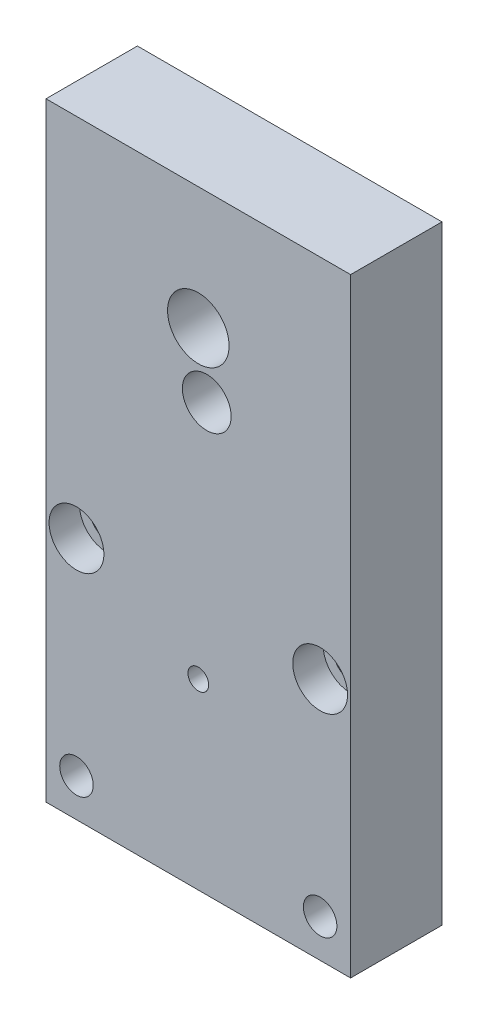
SolidWorks part; units mm, degrees
ref_plane "Face" through (0, 0, 0) normal (0, 0, 1) x (1, 0, 0)
ref_plane "Dessus" through (0, 0, 0) normal (0, 1, 0) x (1, 0, 0)
ref_plane "Droite" through (0, 0, 0) normal (1, 0, 0) x (0, 0, -1)
sketch "Esquisse1" plane through (0, 0, 0) normal (0, 0, 1) x (1, 0, 0)
  line L1 (-50, 0) -> (50, 0)
  line L2 (-50, 0) -> (-50, 200)
  line L3 (-50, 200) -> (50, 200)
  line L4 (50, 0) -> (50, 200)
  dimension "D1" = 200
  dimension "D2" = 100
extrude "Boss.-Extru.1" add sketch "Esquisse1" along normal blind 30
sketch "Esquisse2" plane through (0, 0, 30) normal (0, 0, 1) x (1, 0, 0)
  line L0 (-25, 170) -> (0, 145)
  line L1 (0, 145) -> (25, 170)
  line L2 (25, 170) -> (-25, 170)
  line L3 (0, 145.4) -> (0, -7) construction
  line L4 (50, 200) -> (-50, 200) construction
  line L5 (49.6, 145) -> (151.2, 145) construction
  line L6 (50, 0) -> (50, 200) construction
  dimension "D1" = 30
  dimension "D2" = 50
  dimension "D3" = 25
  dimension "D4" = 50
  dimension "D5" = 90
extrude "Enlèv. mat.-Extru.1" [suppressed] cut sketch "Esquisse2" against normal blind 30
fillet "Congé1" [suppressed] radius 8
sketch "Esquisse3" plane through (0, 0, 30) normal (0, 0, 1) x (1, 0, 0)
  line L0 (50, 0) -> (50, 200) construction
  line L1 (-50, 200) -> (50, 200)
  line L2 (-50, 200) -> (-50, 160)
  line L3 (-50, 160) -> (50, 160)
  line L4 (50, 200) -> (50, 160)
  line L5 (-50, 200) -> (-50, 0) construction
  line L6 (-50, 0) -> (50, 0) construction
  line L8 (50, 200) -> (-50, 200) construction
  dimension "D1" = 160
extrude "Enlèv. mat.-Extru.2" [suppressed] cut sketch "Esquisse3" against normal blind 15
fillet "Congé4" [suppressed] radius 5
fillet "Congé5" [suppressed] radius 5
hole_wizard "Dégagement M101" positions "Esquisse6" profile "Esquisse5" hole size "M10" standard "ISO"
sketch "Esquisse6" plane through (0, 0, 0) normal (0, 0, -1) x (-1, 0, 0)
  line L0 (50, 0) -> (-50, 0) construction
  line L1 (-50, 0) -> (-50, 200) construction
  point P0 (-40, 80)
  point P1 (40, 80)
  point P3 (40, 12.5)
  point P5 (-40, 12.5)
  dimension "D1" = 67.5
  dimension "D2" = 12.5
  dimension "D3" = 80
  dimension "D5" = 67.5
  dimension "D6" = 12.5
  dimension "D7" = 10
sketch "Esquisse5" plane through (40, 80, 0) normal (1, 0, 0) x (0, 1, 0)
  line L0 (0, 0) -> (0, 30)
  line L1 (0, 30) -> (5.5, 30)
  line L2 (5.5, 30) -> (5.5, 0)
  line L5 (5.5, 0) -> (0, 0)
  line L11 (0, -6.35) -> (0, 107.95) construction
  dimension "Diamètre du perçage jusqu'au prochain" = 11
  dimension "Profondeur du perçage jusqu'au prochain" = 30
hole_wizard "Trou taraudé M82" positions "Esquisse12" profile "Esquisse11" tap size "M8" standard "ISO"
sketch "Esquisse12" plane through (0, 0, 0) normal (0, 0, -1) x (-1, 0, 0)
  line L0 (-50, 0) -> (-50, 200) construction
  line L1 (50, 0) -> (-50, 0) construction
  point P0 (0, 60)
  dimension "D1" = 50
  dimension "D2" = 60
sketch "Esquisse11" plane through (0, 60, 0) normal (1, 0, 0) x (0, 1, 0)
  line L0 (0, 0) -> (0, 30)
  line L1 (0, 30) -> (3.4, 30)
  line L2 (3.4, 30) -> (3.4, 0)
  line L5 (3.4, 0) -> (0, 0)
  line L11 (0, -6.35) -> (0, 107.95) construction
  dimension "Diamètre du trou pour taraudage jusqu'au prochain" = 6.8
  dimension "Profondeur du trou pour taraudage jusqu'au prochain" = 30
other "Perçage3" parameters "D1"=10
sketch "Esquisse13" plane through (0, 0, 0) normal (0, 0, -1) x (-1, 0, 0)
  line L0 (-50, 0) -> (-50, 200) construction
  line L1 (50, 0) -> (-50, 0) construction
  circle A0 centre (0, 42) radius 4
  dimension "D1" = 8
  dimension "D2" = 50
  dimension "D3" = 42
hole_wizard "Trou taraudé M83" positions "Esquisse15" profile "Esquisse14" tap size "M8" standard "ISO"
sketch "Esquisse15" [suppressed] plane through (0, 160, 0) normal (0, 1, 0) x (-1, 0, 0)
  line L0 (-15, 30) -> (-50, 30) construction
  line L2 (-50, 15) -> (-50, 0) construction
  point P0 (-35, 22.5)
  dimension "D1" = 7.5
  dimension "D2" = 15
sketch "Esquisse14" plane through (35, 160, 22.5) normal (1, 0, 0) x (0, 0, 1)
  line L0 (0, 0) -> (0, 24.2929)
  line L1 (0, 24.2929) -> (3.4, 22.25)
  line L2 (3.4, 22.25) -> (3.4, 0)
  line L5 (3.4, 0) -> (0, 0)
  line L10 (0, 24.2929) -> (-3.4, 22.25) construction
  line L11 (0, -6.35) -> (0, 107.95) construction
  dimension "Diamètre du trou pour taraudage" = 6.8
  dimension "Profondeur du trou pour taraudage" = 22.25
  dimension "Angle de pointe" = 118
mirror "Symétrie1" [suppressed] about plane through (0, 0, 0) normal (1, 0, 0)
pattern_linear "Répétition linéaire1" count 2 spacing 36 along (0, 1, 0) of "Perçage3"
sketch "Esquisse16" plane through (0, 0, 30) normal (0, 0, 1) x (1, 0, 0)
  circle A1 centre (-40, 80) radius 9
  circle A2 centre (40, 80) radius 9
  dimension "D1" = 18
extrude "Enlèv. mat.-Extru.3" cut sketch "Esquisse16" against normal blind 10
sketch "Esquisse20" plane through (0, 0, 30) normal (0, 0, 1) x (1, 0, 0)
  line L0 (0, 159.75) -> (50, 159.75) construction
  line L1 (50, 0) -> (50, 200) construction
  line L2 (0, 159.75) -> (-50, 159.75) construction
  line L3 (-50, 200) -> (-50, 0) construction
  line L4 (-50, 0) -> (50, 0) construction
  circle A0 centre (0, 159.75) radius 10.1
  dimension "D1" = 20.2
  dimension "D2" = 159.75
extrude "Enlèv. mat.-Extru.4" cut sketch "Esquisse20" against normal through all
hole_wizard "Trou taraudé M84" positions "Esquisse22" profile "Esquisse21" tap size "M8" standard "ISO"
sketch "Esquisse22" plane through (0, 0, 0) normal (0, 0, -1) x (-1, 0, 0)
  line L0 (-50, 200) -> (50, 200) construction
  line L1 (50, 200) -> (50, 0) construction
  point P0 (38, 182.5)
  point P1 (-38, 182.5)
  dimension "D1" = 17.5
  dimension "D2" = 17.5
  dimension "D3" = 76
  dimension "D4" = 12
sketch "Esquisse21" plane through (-38, 182.5, 0) normal (1, 0, 0) x (0, 1, 0)
  line L0 (0, 0) -> (0, 24.2929)
  line L1 (0, 24.2929) -> (3.4, 22.25)
  line L2 (3.4, 22.25) -> (3.4, 0)
  line L5 (3.4, 0) -> (0, 0)
  line L10 (0, 24.2929) -> (-3.4, 22.25) construction
  line L11 (0, -6.35) -> (0, 107.95) construction
  dimension "Diamètre du trou pour taraudage" = 6.8
  dimension "Profondeur du trou pour taraudage" = 22.25
  dimension "Angle de pointe" = 118
sketch "Esquisse23" plane through (0, 0, 30) normal (0, 0, 1) x (1, 0, 0)
  line L0 (0, 212.913) -> (0, 130.189) construction
  line L1 (-60.6645, 159.75) -> (87.5087, 159.75) construction
  line L2 (0, 159.75) -> (8.1372, 101.8505) construction
  circle A0 centre (2.7695, 140.0437) radius 8
  point P7 (0, 159.75)
  dimension "D3" = 16
  dimension "D1" = 8
  dimension "D2" = 19.9
extrude "Enlèv. mat.-Extru.5" cut sketch "Esquisse23" against normal up to next
